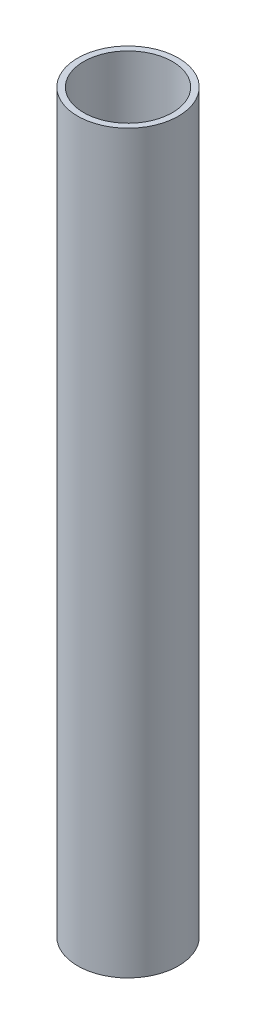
SolidWorks part; units mm, degrees
ref_plane "Front Plane" through (0, 0, 0) normal (0, 0, 1) x (1, 0, 0)
ref_plane "Top Plane" through (0, 0, 0) normal (0, 1, 0) x (1, 0, 0)
ref_plane "Right Plane" through (0, 0, 0) normal (1, 0, 0) x (0, 0, -1)
sketch "Sketch2" plane through (0, 0, 0) normal (0, 1, 0) x (1, 0, 0)
  circle A0 centre (0, 0) radius 6.35 construction
  circle A1 centre (0, 0) radius 7.35
  circle A2 centre (0, 0) radius 8.35
  dimension "D1" = 12.7
  dimension "D2" = 1
  dimension "D3" = 1
extrude "Boss-Extrude1" add sketch "Sketch2" along normal blind 122
